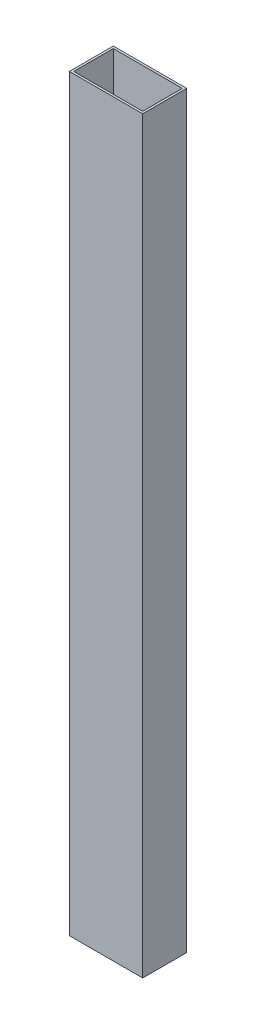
SolidWorks part; units mm, degrees
ref_plane "Front Plane" through (0, 0, 0) normal (0, 0, 1) x (1, 0, 0)
ref_plane "Top Plane" through (0, 0, 0) normal (0, 1, 0) x (1, 0, 0)
ref_plane "Right Plane" through (0, 0, 0) normal (1, 0, 0) x (0, 0, -1)
sketch "Sketch1" plane through (0, 0, 0) normal (0, 1, 0) x (1, 0, 0)
  line L1 (-25, 15) -> (25, 15)
  line L2 (-25, 15) -> (-25, -15)
  line L3 (-25, -15) -> (25, -15)
  line L4 (25, 15) -> (25, -15)
  line L5 (-25, 15) -> (25, -15) construction
  line L6 (-25, -15) -> (25, 15) construction
  point P0 (0, 0)
  dimension "D1" = 30
  dimension "D2" = 50
extrude "Boss-Extrude1" add sketch "Sketch1" along normal blind 510
shell "Shell1" thickness 1.5
